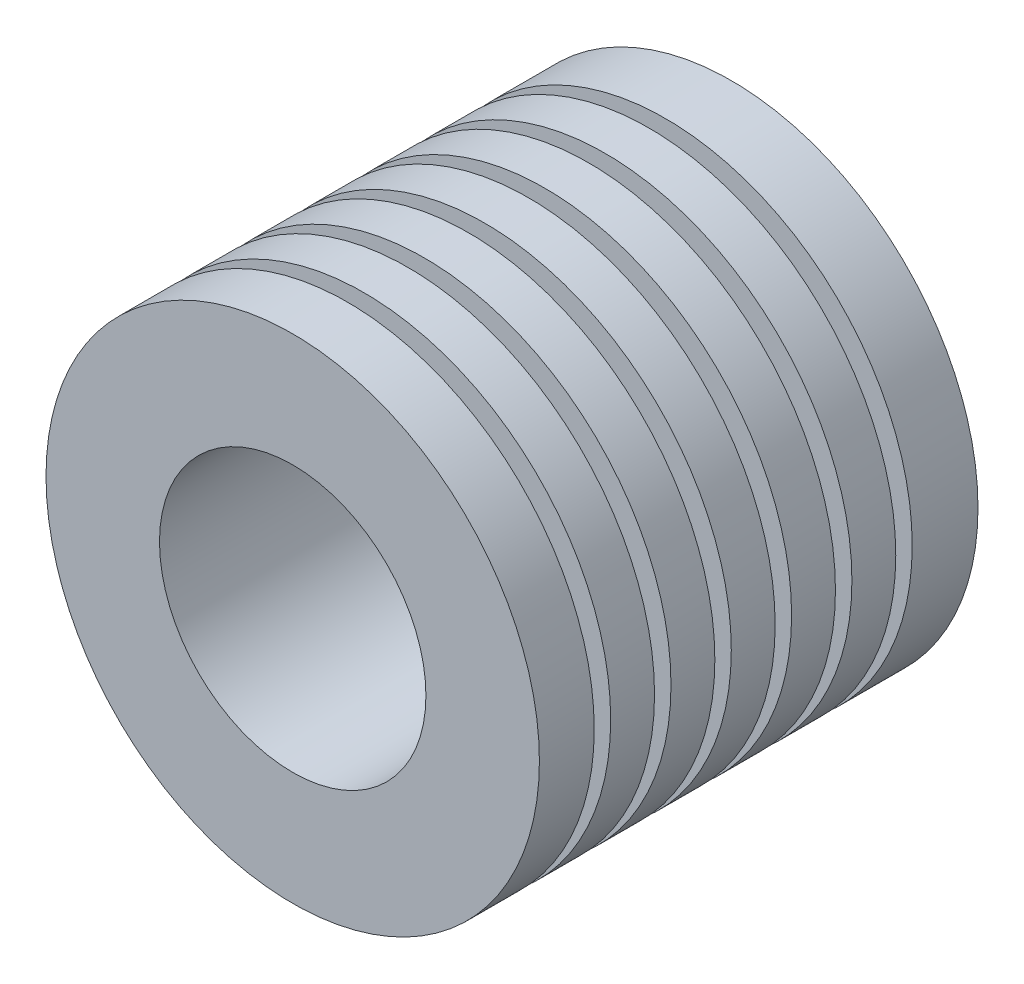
SolidWorks part; units mm, degrees
ref_plane "Front" through (0, 0, 0) normal (0, 0, 1) x (1, 0, 0)
ref_plane "Top" through (0, 0, 0) normal (0, 1, 0) x (1, 0, 0)
ref_plane "Right" through (0, 0, 0) normal (1, 0, 0) x (0, 0, -1)
sketch "Esquisse1" plane through (0, 0, 0) normal (0, 0, 1) x (1, 0, 0)
  circle A0 centre (0, 0) radius 22.5
  dimension "D1" = 45
extrude "Boss.-Extru.1" add sketch "Esquisse1" along normal blind 40
hole_wizard "Diamètre du perçage Ø0.15 (0.15)1" positions "Esquisse3" profile "Esquisse2" hole size "Ø0.15" standard "Ansi Metric"
sketch "Esquisse3" plane through (0, 0, 40) normal (0, 0, 1) x (1, 0, 0)
  point P0 (0, 0)
sketch "Esquisse2" plane through (0, 0, 40) normal (1, 0, 0) x (0, -1, 0)
  line L0 (0, 0) -> (0, 40)
  line L1 (0, 40) -> (12.15, 40)
  line L2 (12.15, 40) -> (12.15, 0)
  line L5 (12.15, 0) -> (0, 0)
  line L11 (0, -6.35) -> (0, 107.95) construction
  dimension "Diamètre du perçage jusqu'au prochain" = 24.3
  dimension "Profondeur du perçage jusqu'au prochain" = 40
sketch "Esquisse4" plane through (0, 0, 0) normal (1, 0, 0) x (0, 0, -1)
  line L0 (50, 0) -> (-50, 0) construction
  line L1 (-35, 25) -> (-33.5, 25)
  line L2 (-35, 25) -> (-35, 15)
  line L3 (-35, 15) -> (-33.5, 15)
  line L4 (-33.5, 25) -> (-33.5, 15)
  line L5 (-40, 22.5) -> (-40, -22.5) construction
  line L6 (13.4445, 0) -> (-62.7044, 0) construction
  dimension "D1" = 15
  dimension "D2" = 25
  dimension "D3" = 5
  dimension "D4" = 1.5
revolve "Enlèvement de matière-Révolution1" cut sketch "Esquisse4" angle 360 about L6
sketch "Esquisse5" plane through (0, 0, 0) normal (1, 0, 0) x (0, 0, -1)
  line L0 (26.2837, 0) -> (-48.0721, 0)
pattern_linear "Répétition linéaire1" count 6 spacing 5.5 along (0, 0, -1) of "Enlèvement de matière-Révolution1"
hole_wizard "Trou taraudé M31" positions "Esquisse7" profile "Esquisse6" tap size "M3" standard "ISO"
sketch "Esquisse7" plane through (0, 0, 0) normal (0, 0, -1) x (-1, 0, 0)
  point P0 (18, 0)
  dimension "D1" = 18
sketch "Esquisse6" plane through (-18, 0, 0) normal (1, 0, 0) x (0, 1, 0)
  line L0 (0, 0) -> (0, 11.5)
  line L1 (0, 11.5) -> (1.25, 11.5)
  line L2 (1.25, 11.5) -> (1.25, 0)
  line L5 (1.25, 0) -> (0, 0)
  line L11 (0, -6.35) -> (0, 107.95) construction
  dimension "Diamètre du trou pour taraudage jusqu'au prochain" = 2.5
  dimension "Profondeur du trou pour taraudage jusqu'au prochain" = 11.5
pattern_circular "Répétition circulaire1" count 3 over 360 about axis through (0, 0, 0) along (0, 0, 1) of "Trou taraudé M31"
